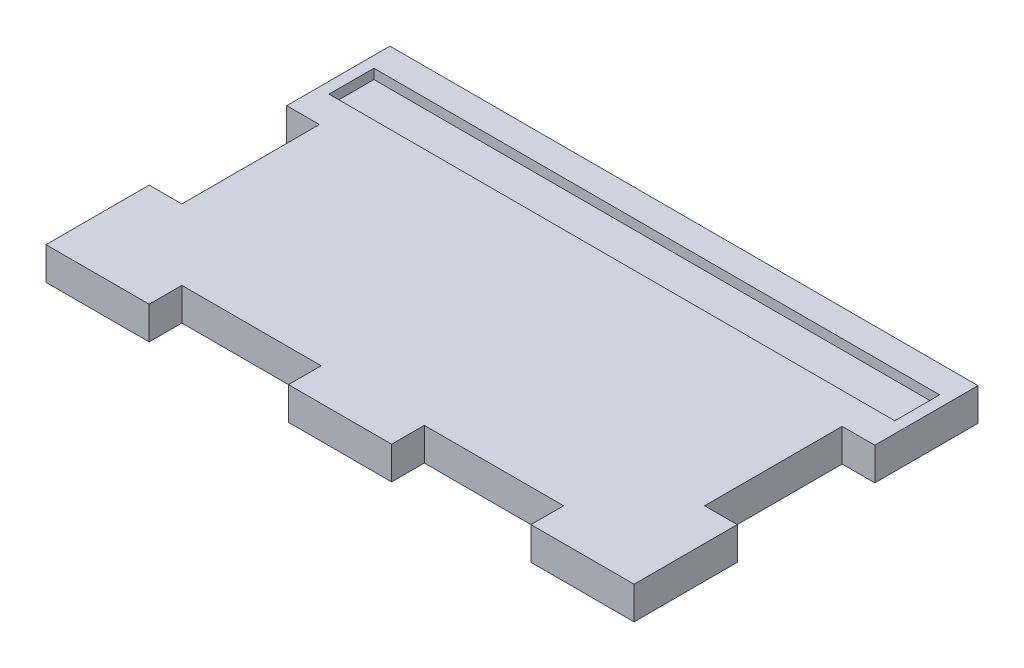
SolidWorks part; units mm, degrees
ref_plane "Plan de face" through (0, 0, 0) normal (0, 0, 1) x (1, 0, 0)
ref_plane "Plan de dessus" through (0, 0, 0) normal (0, 1, 0) x (1, 0, 0)
ref_plane "Plan de droite" through (0, 0, 0) normal (1, 0, 0) x (0, 0, -1)
sketch "Esquisse1" plane through (0, 0, 0) normal (0, 1, 0) x (1, 0, 0)
  line L1 (-171, 100) -> (171, 100)
  line L2 (-171, 100) -> (-171, -100)
  line L3 (-171, -100) -> (171, -100)
  line L4 (171, 100) -> (171, -100)
  line L5 (-171, 100) -> (171, -100) construction
  line L6 (-171, -100) -> (171, 100) construction
  point P0 (0, 0)
  dimension "D1" = 342
  dimension "D2" = 200
extrude "Boss.-Extru.1" add sketch "Esquisse1" along normal blind 19
sketch "Esquisse2" plane through (0, 19, 0) normal (0, 1, 0) x (1, 0, 0)
  line L0 (171, -100) -> (171, 100) construction
  line L1 (171, 40) -> (152, 40)
  line L2 (171, 40) -> (171, -40)
  line L3 (171, -40) -> (152, -40)
  line L4 (152, 40) -> (152, -40)
  line L5 (-171, -100) -> (171, -100) construction
  line L6 (111, -100) -> (30, -100)
  line L7 (111, -100) -> (111, -81)
  line L8 (111, -81) -> (30, -81)
  line L9 (30, -100) -> (30, -81)
  point P8 (171, 0)
  dimension "D1" = 60
  dimension "D2" = 19
  dimension "D3" = 60
  dimension "D4" = 30
extrude "Enlèv. mat.-Extru.1" cut sketch "Esquisse2" against normal up to next
mirror "Symétrie2" about plane through (0, 0, 0) normal (1, 0, 0) of "Enlèv. mat.-Extru.1"
sketch "Esquisse4" plane through (0, 19, 0) normal (0, 1, 0) x (1, 0, 0)
  line L1 (-164.5, 84.2) -> (164.5, 84.2)
  line L2 (-164.5, 84.2) -> (-164.5, 58.1)
  line L3 (-164.5, 58.1) -> (164.5, 58.1)
  line L4 (164.5, 84.2) -> (164.5, 58.1)
  line L6 (171, 100) -> (-171, 100) construction
  line L7 (171, 75.5336) -> (164.5, 75.5336) construction
  line L8 (171, 40) -> (171, 100) construction
  line L10 (-164.5, 75.5336) -> (-171, 75.5336) construction
  line L11 (-171, 100) -> (-171, 40) construction
  dimension "D1" = 15.8
  dimension "D2" = 26.1
  dimension "D3" = 6.5
extrude "Enlèv. mat.-Extru.2" cut sketch "Esquisse4" against normal blind 5.7
